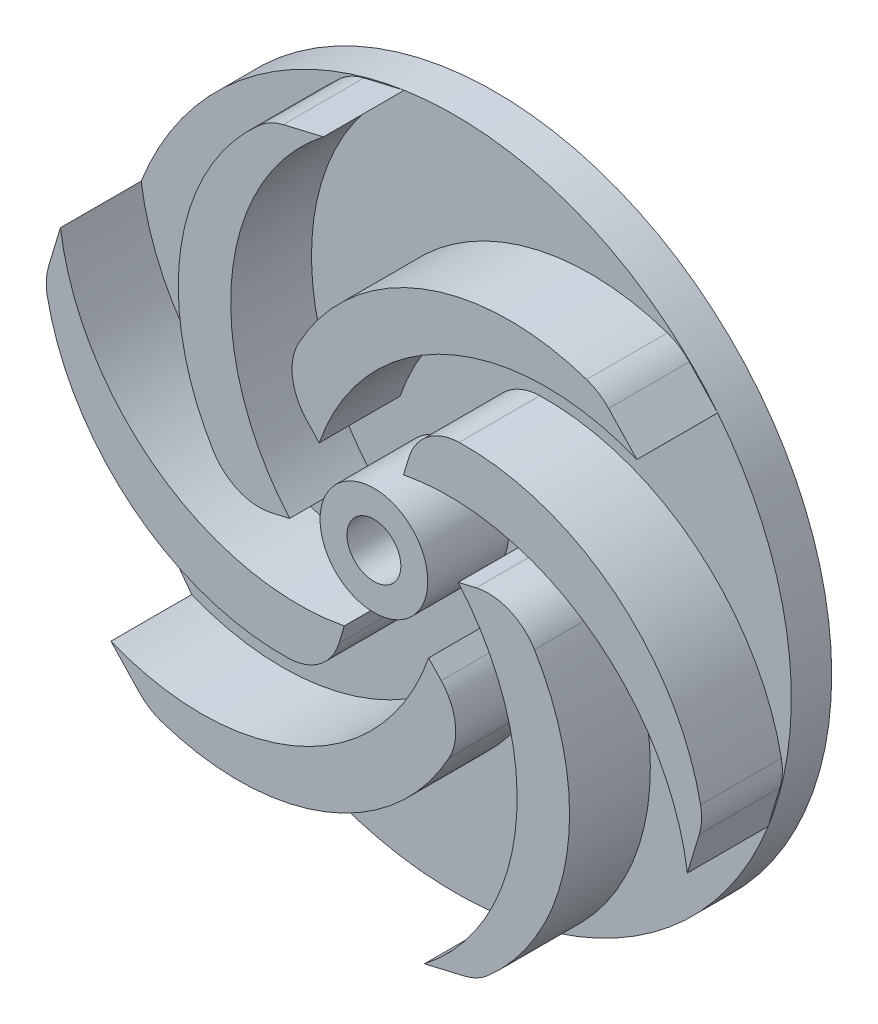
SolidWorks part; units mm, degrees
ref_plane "Alzado" through (0, 0, 0) normal (0, 0, 1) x (1, 0, 0)
ref_plane "Planta" through (0, 0, 0) normal (0, 1, 0) x (1, 0, 0)
ref_plane "Vista lateral" through (0, 0, 0) normal (1, 0, 0) x (0, 0, -1)
sketch "Croquis1" plane through (0, 0, 0) normal (0, 0, 1) x (1, 0, 0)
  circle A0 centre (0, 0) radius 12.5
  circle A1 centre (0, 0) radius 1
  dimension "D1" = 25
  dimension "D2" = 2
extrude "Saliente-Extruir1" add sketch "Croquis1" along normal blind 1.5
sketch "Croquis2" plane through (0, 0, 1.5) normal (0, 0, 1) x (1, 0, 0)
  circle A0 centre (0, 0) radius 1
  circle A1 centre (0, 0) radius 2
  dimension "D1" = 4
  dimension "D2" = 2
extrude "Saliente-Extruir2" add sketch "Croquis2" along normal blind 3
sketch "Croquis3" plane through (0, 0, 1.5) normal (0, 0, 1) x (1, 0, 0)
  line L0 (-3.4, 3.9) -> (-2.0305, 2.4425)
  line L1 (8.3957, 9.2608) -> (9.7652, 7.8032)
  line L2 (12.2179, -2.6405) -> (11.6404, -4.5553)
  line L3 (1.6775, 4.8945) -> (1.1, 2.9797)
  line L4 (3.8222, -11.9013) -> (1.8752, -12.3585)
  line L5 (5.0775, 0.9945) -> (3.1305, 0.5372)
  line L6 (-8.3957, -9.2608) -> (-9.7652, -7.8032)
  line L7 (3.4, -3.9) -> (2.0305, -2.4425)
  line L8 (-12.2179, 2.6405) -> (-11.6404, 4.5553)
  line L9 (-1.6775, -4.8945) -> (-1.1, -2.9797)
  line L10 (-3.8222, 11.9013) -> (-1.8752, 12.3585)
  line L11 (-5.0775, -0.9945) -> (-3.1305, -0.5372)
  circle A0 centre (0, 0) radius 12.5 construction
  arc A1 (-3.4, 3.9) -> (8.3957, 9.2608) centre (5.0373, 0.9926) cw
  arc A2 (-2.0305, 2.4425) -> (9.7652, 7.8032) centre (6.4068, -0.465) cw
  arc A3 (1.6775, 4.8945) -> (12.2179, -2.6405) centre (3.3783, -3.8662) cw
  arc A4 (1.1, 2.9797) -> (11.6404, -4.5553) centre (2.8007, -5.781) cw
  arc A5 (5.0775, 0.9945) -> (3.8222, -11.9013) centre (-1.6591, -4.8588) cw
  arc A6 (3.1305, 0.5372) -> (1.8752, -12.3585) centre (-3.6061, -5.316) cw
  arc A7 (3.4, -3.9) -> (-8.3957, -9.2608) centre (-5.0373, -0.9926) cw
  arc A8 (2.0305, -2.4425) -> (-9.7652, -7.8032) centre (-6.4068, 0.465) cw
  arc A9 (-1.6775, -4.8945) -> (-12.2179, 2.6405) centre (-3.3783, 3.8662) cw
  arc A10 (-1.1, -2.9797) -> (-11.6404, 4.5553) centre (-2.8007, 5.781) cw
  arc A11 (-5.0775, -0.9945) -> (-3.8222, 11.9013) centre (1.6591, 4.8588) cw
  arc A12 (-3.1305, -0.5372) -> (-1.8752, 12.3585) centre (3.6061, 5.316) cw
  point P42 (0, 0)
  dimension "D1" = 25
  dimension "D2" = 2
  dimension "D3" = 2
  dimension "D4" = 2
  dimension "D5" = 6
extrude "Saliente-Extruir3" add sketch "Croquis3" along normal blind 3
fillet "Redondeo1" radius 2 12 edges at (-3.4, 3.9, 3) (-5.0775, -0.9945, 3) (-1.6775, -4.8945, 3) (3.4, -3.9, 3) (1.6775, 4.8945, 3) (5.0775, 0.9945, 3) (8.3957, 9.2608, 3) (-3.8222, 11.9013, 3) (-12.2179, 2.6405, 3) (-8.3957, -9.2608, 3) (3.8222, -11.9013, 3) (12.2179, -2.6405, 3)
